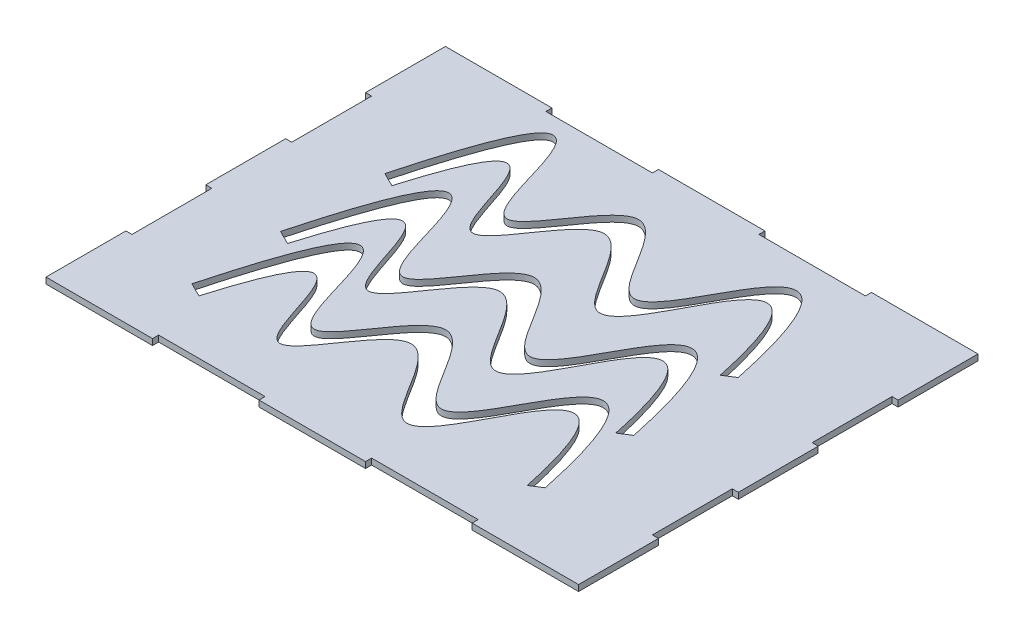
SolidWorks part; units mm, degrees
ref_plane "Alzado" through (0, 0, 0) normal (0, 0, 1) x (1, 0, 0)
ref_plane "Planta" through (0, 0, 0) normal (0, 1, 0) x (1, 0, 0)
ref_plane "Vista lateral" through (0, 0, 0) normal (1, 0, 0) x (0, 0, -1)
sketch "Sketch2" plane through (0, 0, 0) normal (0, 1, 0) x (1, 0, 0)
  line L0 (-100, -45) -> (-97.72, -45)
  line L5 (-100, 75) -> (100, -75) construction
  line L6 (-100, -75) -> (100, 75) construction
  line L7 (-97.72, -45) -> (-97.72, -15)
  line L8 (-97.72, -15) -> (-100, -15)
  line L9 (-100, -15) -> (-100, 15)
  line L10 (-100, 15) -> (-97.72, 15)
  line L11 (-97.72, 15) -> (-97.72, 45)
  line L12 (-97.72, 45) -> (-100, 45)
  line L13 (-100, 45) -> (-100, 75)
  line L14 (-60, 75) -> (-60, 72.72)
  line L15 (-60, 72.72) -> (-20, 72.72)
  line L16 (-20, 72.72) -> (-20, 75)
  line L17 (-20, 75) -> (20, 75)
  line L18 (20, 75) -> (20, 72.72)
  line L19 (20, 72.72) -> (60, 72.72)
  line L20 (60, 72.72) -> (60, 75)
  line L21 (60, 75) -> (100, 75)
  line L22 (100, 45) -> (97.72, 45)
  line L23 (97.72, 45) -> (97.72, 15)
  line L24 (97.72, 15) -> (100, 15)
  line L25 (100, 15) -> (100, -15)
  line L26 (100, -15) -> (97.72, -15)
  line L27 (97.72, -15) -> (97.72, -45)
  line L28 (97.72, -45) -> (100, -45)
  line L29 (100, -45) -> (100, -75)
  line L30 (60, -75) -> (60, -72.72)
  line L31 (60, -72.72) -> (20, -72.72)
  line L32 (20, -72.72) -> (20, -75)
  line L33 (20, -75) -> (-20, -75)
  line L34 (-20, -75) -> (-20, -72.72)
  line L35 (-20, -72.72) -> (-60, -72.72)
  line L36 (-60, -72.72) -> (-60, -75)
  line L37 (-60, -75) -> (-100, -75)
  line L38 (-100, -75) -> (-100, -45)
  line L39 (-100, 75) -> (-60, 75)
  line L40 (100, 45) -> (100, 75)
  line L41 (60, -75) -> (100, -75)
  point P0 (0, 0)
  point P5 (-100, 45)
  point P6 (-100, 15)
  point P8 (-100, -15)
  point P9 (-100, -45)
  point P15 (-60, 75)
  point P19 (-20, 75)
  point P20 (20, 75)
  point P21 (60, 75)
  point P30 (100, 45)
  point P31 (100, 15)
  point P32 (100, -15)
  point P33 (100, -45)
  point P34 (-60, -75)
  point P35 (-20, -75)
  point P36 (20, -75)
  point P37 (60, -75)
extrude "Boss-Extrude2" add sketch "Sketch2" along normal blind 2.28
sketch "Sketch3" plane through (0, 2.28, 0) normal (0, 1, 0) x (1, 0, 0)
  line L0 (-70.023, 22.2895) -> (-64.777, 19.6664)
  line L1 (58.5053, 19.6664) -> (62.6584, 22.2895)
  line L2 (-70.81, -16.1173) -> (-65.5639, -18.7403)
  line L3 (57.7183, -18.7403) -> (61.8715, -16.1173)
  line L4 (-70.4107, -49.786) -> (-65.1647, -52.4091)
  line L5 (58.1176, -52.4091) -> (62.2707, -49.786)
  spline S0 degree 3 poles (-64.777, 19.6664) (-45.6676, 84.3341) (-43.396, -19.9318) (-8.3369, 68.6625) (22.529, -29.0482) (42.3073, 95.6925) (58.5053, 19.6664) knots 0 0 0 0 0.279178 0.456783 0.640081 1 1 1 1
  spline S1 degree 3 poles (-70.023, 22.2895) (-44.8254, 116.569) (-44.1829, -15.1439) (-6.2649, 79.5906) (24.1808, -17.9381) (44.2498, 108.3632) (62.6584, 22.2895) knots 0 0 0 0 0.320699 0.490092 0.664917 1 1 1 1
  spline S2 degree 3 poles (-65.5639, -18.7403) (-46.4545, 45.9274) (-44.1829, -58.3386) (-9.1238, 30.2558) (21.7421, -67.4549) (41.5204, 57.2858) (57.7183, -18.7403) knots 0 0 0 0 0.279178 0.456783 0.640081 1 1 1 1
  spline S3 degree 3 poles (-70.81, -16.1173) (-45.6123, 78.1622) (-44.9698, -53.5506) (-7.0518, 41.1839) (23.3938, -56.3448) (43.4629, 69.9564) (61.8715, -16.1173) knots 0 0 0 0 0.320699 0.490092 0.664917 1 1 1 1
  spline S4 degree 3 poles (-65.1647, -52.4091) (-46.0553, 12.2586) (-43.7837, -92.0073) (-8.7246, -3.413) (22.1414, -101.1237) (41.9196, 23.617) (58.1176, -52.4091) knots 0 0 0 0 0.279178 0.456783 0.640081 1 1 1 1
  spline S5 degree 3 poles (-70.4107, -49.786) (-45.213, 44.4935) (-44.5706, -87.2194) (-6.6526, 7.5151) (23.7931, -90.0136) (43.8621, 36.2876) (62.2707, -49.786) knots 0 0 0 0 0.320699 0.490092 0.664917 1 1 1 1
extrude "Cut-Extrude1" cut sketch "Sketch3" against normal blind 10
equation "\"largo\"= 200mm"
equation "\"ancho\"= 150mm"
equation "\"altura\"= 6mm"
equation "\"divisor de largo\"= \"largo\" / 5"
equation "\"divisor de ancho\"= \"ancho\" / 5"
equation "\"divisor de altura\"= \"altura\" / 5"
equation "\"D1@Sketch2\"=\"largo\""
equation "\"D2@Sketch2\"=\"ancho\""
equation "\"madera\"= 2.28"
equation "\"D1@Boss-Extrude2\"=\"madera\""
